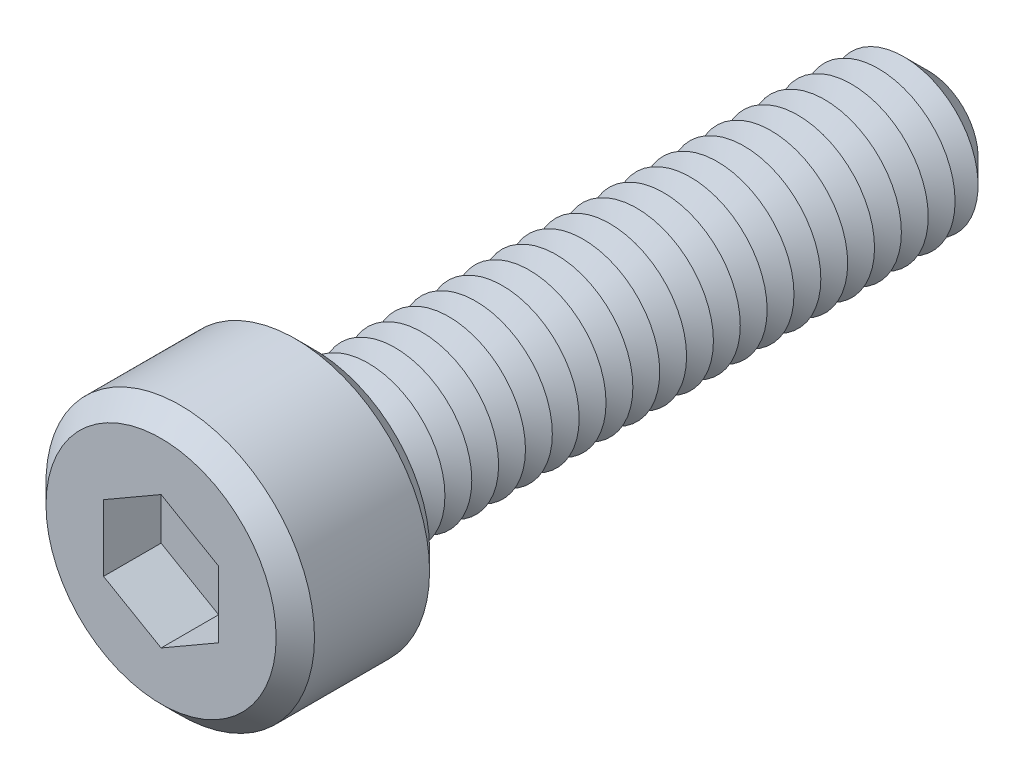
SolidWorks part; units mm, degrees
ref_plane "Front Plane" through (0, 0, 0) normal (0, 0, 1) x (1, 0, 0)
ref_plane "Top Plane" through (0, 0, 0) normal (0, 1, 0) x (1, 0, 0)
ref_plane "Right Plane" through (0, 0, 0) normal (1, 0, 0) x (0, 0, -1)
sketch "Sketch1" plane through (0, 0, 0) normal (0, 0, 1) x (1, 0, 0)
  circle A0 centre (0, 0) radius 3.5
  dimension "D1" = 7
extrude "Boss-Extrude1" add sketch "Sketch1" along normal blind 4
sketch "Sketch2" plane through (0, 0, 0) normal (0, 0, -1) x (-1, 0, 0)
  circle A0 centre (0, 0) radius 2
  dimension "D1" = 4
extrude "Boss-Extrude2" add sketch "Sketch2" along normal blind 16
chamfer "Chamfer1" distance 0.7 angle 45 1 edges at (-2, 0, -16)
sketch "Sketch3" plane through (0, 0, 0) normal (1, 0, 0) x (0, 0, -1)
  line L0 (-2.5121, 0) -> (4.5776, 0) construction
sketch "Sketch4" plane through (0, 0, 0) normal (1, 0, 0) x (0, 0, -1)
  line L0 (0, 2) -> (0.35, 1.3938)
  line L1 (0.35, 1.3938) -> (0.7, 2)
  line L2 (15.3, 2) -> (0, 2) construction
  line L3 (0.7, 2) -> (0, 2)
  dimension "D1" = 0.7
revolve "Cut-Revolve1" cut sketch "Sketch4" angle 360 about L0
pattern_linear "LPattern1" count 22 spacing 0.7 along (0, 0, -1) of "Cut-Revolve1"
sketch "Sketch5" plane through (0, 0, 4) normal (0, 0, 1) x (1, 0, 0)
  line L1 (0, 1.7321) -> (-1.5, 0.866)
  line L2 (-1.5, 0.866) -> (-1.5, -0.866)
  line L3 (-1.5, -0.866) -> (0, -1.7321)
  line L4 (0, -1.7321) -> (1.5, -0.866)
  line L5 (1.5, -0.866) -> (1.5, 0.866)
  line L6 (1.5, 0.866) -> (0, 1.7321)
  circle A0 centre (0, 0) radius 1.5 construction
  dimension "D1" = 3
extrude "Cut-Extrude1" cut sketch "Sketch5" against normal blind 1.5
sketch "Sketch6" plane through (0, 0, 2.5) normal (0, 0, 1) x (1, 0, 0)
  circle A0 centre (0, 0) radius 0.5
  dimension "D1" = 1
extrude "Cut-Extrude2" cut sketch "Sketch6" against normal up to surface (18.5 mm away)
chamfer "Chamfer2" distance 0.5 angle 45 2 edges at (3.5, 0, 0) (3.5, 0, 4)
